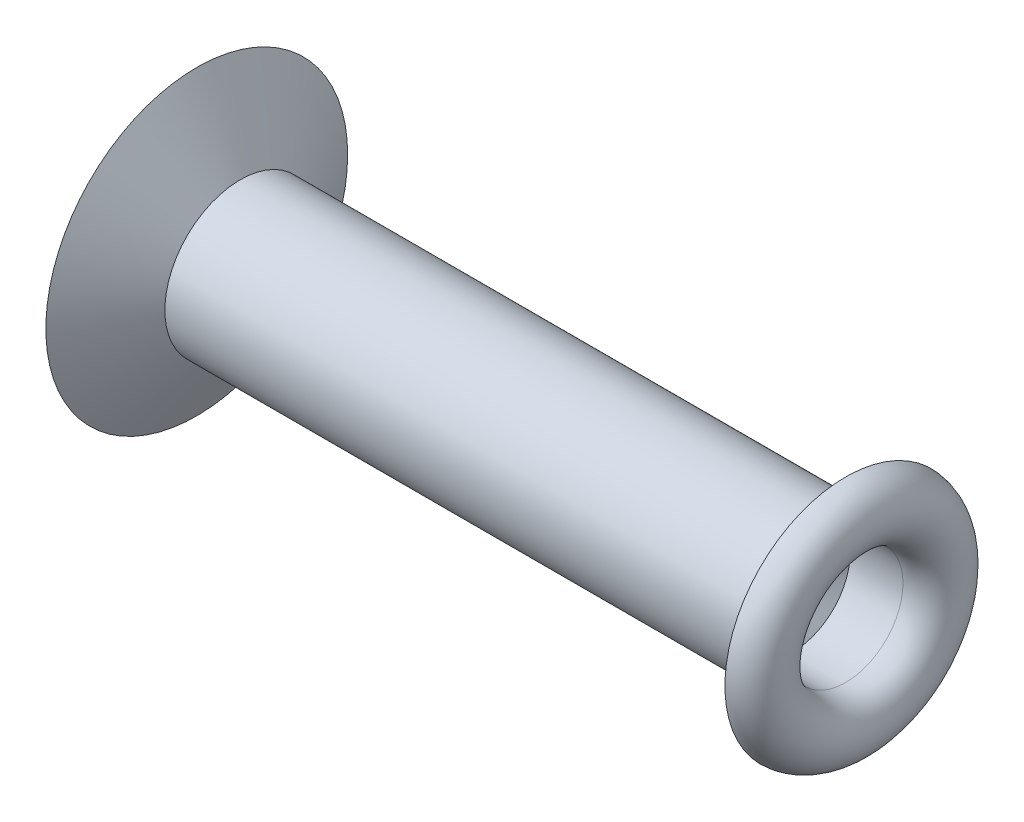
SolidWorks part; units mm, degrees
ref_plane "Plane1" through (0, 0, 0) normal (0, 0, 1) x (1, 0, 0)
ref_plane "Plane2" through (0, 0, 0) normal (0, 1, 0) x (1, 0, 0)
ref_plane "Plane3" through (0, 0, 0) normal (1, 0, 0) x (0, 0, -1)
other "Configuration Table"
sketch "Sketch1" plane through (0, 0, 0) normal (0, 0, 1) x (1, 0, 0)
  line L0 (40.3769, 0) -> (-46.1263, 0) construction
  line L1 (0, 8) -> (0, 6.7941)
  line L2 (-0.1025, 5) -> (-40.1132, 5)
  line L3 (-43, 0) -> (-43, 10)
  line L4 (-5.7833, 0) -> (-43, 0)
  line L5 (-43, 10) -> (-40.1132, 5)
  line L6 (0, 3.8) -> (-3.5, 3.8)
  line L7 (-3.5, 3.8) -> (-5.7833, 0)
  line L8 (-3.5, -3.8) -> (-5.7833, 0) construction
  line L9 (-0.1025, 5.9) -> (2, 5.9) construction
  line L10 (7, 0) -> (7, 21.0413) construction
  line L11 (-43, -10) -> (-40.1132, -5) construction
  arc A1 (0, 3.8) -> (0, 8) centre (-0.1025, 5.9) ccw
  arc A2 (-0.1025, 5) -> (0, 6.7941) centre (-0.1025, 5.9) ccw
  dimension "D1" = 118
  dimension "Diameter" = 10
  dimension "GripLength" = 43
  dimension "D2" = 120
  dimension "HeadDia" = 20
  dimension "HoleDepth" = 10.5
  dimension "HoleDia" = 7.6
  dimension "HeadKA" = 2
  dimension "HeadDiaA" = 16
  dimension "Length" = 50
revolve "Base-Revolve" add sketch "Sketch1" angle 360 about L0
